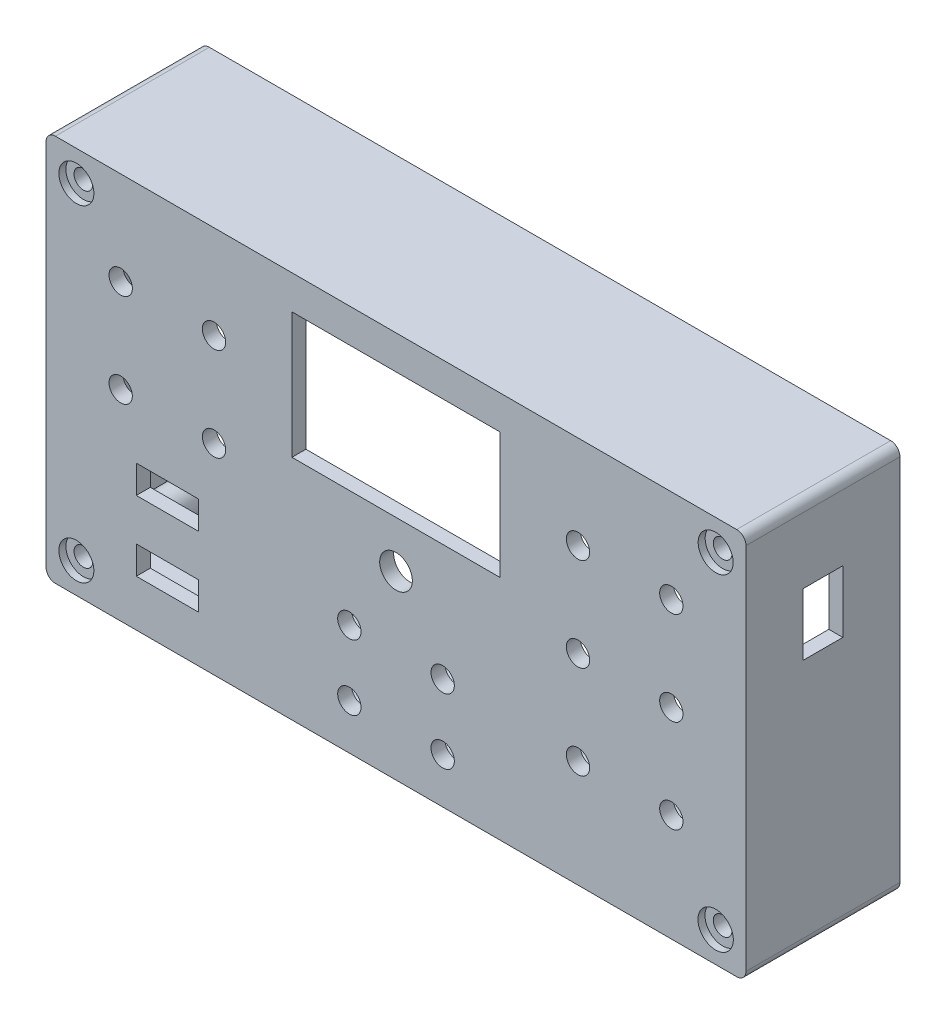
SolidWorks part; units mm, degrees
ref_plane "Alzado" through (0, 0, 0) normal (0, 0, 1) x (1, 0, 0)
ref_plane "Planta" through (0, 0, 0) normal (0, 1, 0) x (1, 0, 0)
ref_plane "Vista lateral" through (0, 0, 0) normal (1, 0, 0) x (0, 0, -1)
sketch "Croquis1" plane through (0, 0, 0) normal (0, 0, 1) x (1, 0, 0)
  line L1 (75, -41.5) -> (-75, -41.5)
  line L2 (75, -41.5) -> (75, 41.5)
  line L3 (75, 41.5) -> (-75, 41.5)
  line L4 (-75, -41.5) -> (-75, 41.5)
  line L5 (75, -41.5) -> (-75, 41.5) construction
  line L6 (75, 41.5) -> (-75, -41.5) construction
  point P0 (0, 0)
extrude "Saliente-Extruir1" add sketch "Croquis1" against normal blind 3
sketch "Croquis2" plane through (0, 0, -3) normal (0, 0, -1) x (-1, 0, 0)
  line L0 (-75, 41.5) -> (-72, 41.5) construction
  line L1 (-75, 41.5) -> (75, 41.5) construction
  line L2 (-72, 41.5) -> (-72, 38.5) construction
  line L3 (75, -41.5) -> (75, -38.5) construction
  line L4 (75, 41.5) -> (75, -41.5) construction
  line L5 (75, -38.5) -> (72, -38.5) construction
  line L7 (72, -38.5) -> (-72, -38.5)
  line L8 (72, -38.5) -> (72, 38.5)
  line L9 (72, 38.5) -> (-72, 38.5)
  line L10 (-72, -38.5) -> (-72, 38.5)
  line L14 (75, -41.5) -> (75, 41.5)
  line L15 (75, 41.5) -> (-75, 41.5)
  line L16 (-75, 41.5) -> (-75, -41.5)
  line L17 (-75, -41.5) -> (75, -41.5)
  line L18 (75, -41.5) -> (75, 41.5)
  line L19 (75, 41.5) -> (-75, 41.5)
  line L20 (-75, 41.5) -> (-75, -41.5)
  line L21 (-75, -41.5) -> (75, -41.5)
  dimension "D1" = 0
extrude "Saliente-Extruir2" add sketch "Croquis2" along normal blind 30
sketch "Croquis4" plane through (0, 0, -3) normal (0, 0, -1) x (-1, 0, 0)
  line L0 (-72, 35) -> (-72, 38.5)
  line L2 (-72, 38.5) -> (-68.5, 38.5)
  line L3 (0, 0) -> (0, 8.8651) construction
  line L4 (0, 0) -> (-5.9844, 0) construction
  line L6 (-72, -35) -> (-72, -38.5)
  line L7 (-72, -38.5) -> (-68.5, -38.5)
  line L8 (72, -35) -> (72, -38.5)
  line L9 (72, -38.5) -> (68.5, -38.5)
  line L10 (68.5, 38.5) -> (72, 38.5)
  line L11 (72, 38.5) -> (72, 35)
  arc A0 (-72, 35) -> (-68.5, 38.5) centre (-68.5, 35) ccw
  circle A1 centre (-68.5, 35) radius 2
  circle A2 centre (-68.5, -35) radius 2
  arc A3 (-72, -35) -> (-68.5, -38.5) centre (-68.5, -35) cw
  arc A4 (72, -35) -> (68.5, -38.5) centre (68.5, -35) ccw
  circle A5 centre (68.5, -35) radius 2
  circle A6 centre (68.5, 35) radius 2
  arc A7 (72, 35) -> (68.5, 38.5) centre (68.5, 35) cw
extrude "Saliente-Extruir8" add sketch "Croquis4" along normal blind 30
sketch "Croquis5" plane through (0, 0, -3) normal (0, 0, -1) x (-1, 0, 0)
  circle A1 centre (-68.5, 35) radius 2
  circle A2 centre (-68.5, 35) radius 2
  circle A3 centre (-68.5, -35) radius 2
  circle A4 centre (-68.5, -35) radius 2
  circle A5 centre (68.5, -35) radius 2
  circle A6 centre (68.5, -35) radius 2
  circle A7 centre (68.5, 35) radius 2
  circle A8 centre (68.5, 35) radius 2
  dimension "D1" = 0
  dimension "D2" = 0
  dimension "D3" = 0
  dimension "D4" = 0
extrude "Cortar-Extruir1" cut sketch "Croquis5" against normal blind 3
sketch "Croquis6" plane through (0, 0, 0) normal (0, 0, 1) x (1, 0, 0)
  line L0 (0, 41.5) -> (0, 0) construction
  line L1 (75, 41.5) -> (-75, 41.5) construction
  line L3 (22.3, 7.25) -> (-22.3, 7.25)
  line L4 (22.3, 7.25) -> (22.3, 34.25)
  line L5 (22.3, 34.25) -> (-22.3, 34.25)
  line L6 (-22.3, 7.25) -> (-22.3, 34.25)
  line L7 (22.3, 7.25) -> (-22.3, 34.25) construction
  line L8 (22.3, 34.25) -> (-22.3, 7.25) construction
  point P5 (0, 20.75)
extrude "Cortar-Extruir2" cut sketch "Croquis6" against normal blind 3
sketch "Croquis7" plane through (0, 0, 0) normal (0, 0, 1) x (1, 0, 0)
  line L0 (0, 7.25) -> (0, -2.75) construction
  line L1 (-22.3, 7.25) -> (22.3, 7.25) construction
  circle A0 centre (0, -2.75) radius 7.5 construction
  circle A1 centre (0, -2.75) radius 3.5
extrude "Cortar-Extruir3" cut sketch "Croquis7" against normal blind 3
sketch "Croquis8" plane through (0, 0, 0) normal (0, 0, 1) x (1, 0, 0)
  line L0 (0, 7.25) -> (0, -17.75) construction
  line L1 (-22.3, 7.25) -> (22.3, 7.25) construction
  line L2 (0, -17.75) -> (-10, -17.75) construction
  circle A0 centre (-10, -17.75) radius 2.5
  circle A1 centre (10, -17.75) radius 2.5
extrude "Cortar-Extruir4" cut sketch "Croquis8" against normal blind 3
sketch "Croquis9" plane through (0, 0, 0) normal (0, 0, 1) x (1, 0, 0)
  line L0 (0, -2.75) -> (0, -31.75) construction
  line L1 (0, -31.75) -> (-10, -31.75) construction
  circle A0 centre (-10, -31.75) radius 2.5
  circle A1 centre (10, -31.75) radius 2.5
extrude "Cortar-Extruir5" cut sketch "Croquis9" against normal blind 3
sketch "Croquis10" plane through (0, 0, 0) normal (0, 0, 1) x (1, 0, 0)
  line L0 (75, 41.5) -> (75, 21.5) construction
  line L1 (75, -41.5) -> (75, 41.5) construction
  line L2 (75, 21.5) -> (49, 21.5) construction
  line L3 (49, 21.5) -> (49, 25.4762) construction
  line L4 (49, 21.5) -> (39, 21.5) construction
  line L5 (0, 7.25) -> (0, 13.805) construction
  line L6 (-22.3, 7.25) -> (22.3, 7.25) construction
  line L7 (-49, 21.5) -> (-39, 21.5) construction
  line L8 (-49, 21.5) -> (-49, 25.4762) construction
  circle A0 centre (39, 21.5) radius 2.5
  circle A1 centre (59, 21.5) radius 2.5
  circle A2 centre (59, 1.5) radius 2.5
  circle A3 centre (59, -18.5) radius 2.5
  circle A4 centre (39, 1.5) radius 2.5
  circle A5 centre (39, -18.5) radius 2.5
  circle A7 centre (-39, 1.5) radius 2.5
  circle A9 centre (-59, 1.5) radius 2.5
  circle A10 centre (-59, 21.5) radius 2.5
  circle A11 centre (-39, 21.5) radius 2.5
  dimension "D1" = 2
  dimension "D2" = 3
extrude "Cortar-Extruir6" cut sketch "Croquis10" against normal blind 3
sketch "Croquis11" plane through (0, 0, 0) normal (0, 0, 1) x (1, 0, 0)
  line L0 (-56.5, 1.5) -> (-41.5, 1.5) construction
  line L1 (-49, 1.5) -> (-49, -13.5) construction
  line L2 (-42.35, -31.5) -> (-55.65, -25.5) construction
  line L3 (-42.35, -16.5) -> (-55.65, -16.5)
  line L4 (-42.35, -16.5) -> (-42.35, -10.5)
  line L5 (-42.35, -10.5) -> (-55.65, -10.5)
  line L6 (-55.65, -16.5) -> (-55.65, -10.5)
  line L7 (-42.35, -16.5) -> (-55.65, -10.5) construction
  line L8 (-42.35, -10.5) -> (-55.65, -16.5) construction
  line L9 (-42.35, -25.5) -> (-55.65, -31.5) construction
  line L10 (-42.35, -31.5) -> (-42.35, -25.5)
  line L11 (-42.35, -31.5) -> (-55.65, -31.5)
  line L12 (-55.65, -31.5) -> (-55.65, -25.5)
  line L13 (-42.35, -25.5) -> (-55.65, -25.5)
  circle A0 centre (-59, 1.5) radius 2.5 construction
  circle A1 centre (-39, 1.5) radius 2.5 construction
  dimension "D1" = 2
extrude "Cortar-Extruir7" cut sketch "Croquis11" against normal blind 3
sketch "Croquis13" plane through (0, -41.5, 0) normal (0, -1, 0) x (1, 0, 0)
  line L0 (75, 0) -> (65, 0) construction
  line L1 (-75, 0) -> (75, 0) construction
  line L2 (65, 0) -> (65, -33) construction
  line L3 (65, -16.5) -> (11.2, -16.5) construction
  line L4 (65, -4.35) -> (53.2, -4.35) construction
  line L5 (65, -28.65) -> (11.2, -28.65) construction
  line L6 (65, -28.65) -> (65, -4.35) construction
  line L7 (65, -4.35) -> (11.2, -4.35) construction
  line L8 (11.2, -28.65) -> (11.2, -4.35) construction
  line L9 (65, -28.65) -> (11.2, -4.35) construction
  line L10 (65, -4.35) -> (11.2, -28.65) construction
  line L11 (53.2, -4.35) -> (53.2, -6.85) construction
  line L12 (11.2, -28.65) -> (20.2, -28.65) construction
  line L13 (20.2, -28.65) -> (20.2, -26.15) construction
  circle A0 centre (20.2, -26.15) radius 2
  circle A1 centre (53.2, -6.85) radius 2
  point P9 (38.1, -16.5)
extrude "Cortar-Extruir8" cut sketch "Croquis13" against normal blind 3
sketch "Croquis14" plane through (0, -41.5, 0) normal (0, -1, 0) x (1, 0, 0)
  circle A0 centre (53.2, -6.85) radius 3.75
  circle A1 centre (20.2, -26.15) radius 3.75
  circle A2 centre (20.2, -26.15) radius 2 construction
  circle A3 centre (20.2, -26.15) radius 2
  circle A4 centre (53.2, -6.85) radius 2 construction
  circle A5 centre (53.2, -6.85) radius 2
extrude "Cortar-Extruir9" cut sketch "Croquis14" against normal blind 1.5
sketch "Croquis15" plane through (0, 0, 0) normal (0, 0, 1) x (1, 0, 0)
  circle A0 centre (-68.5, 35) radius 3.75
  circle A1 centre (-68.5, -35) radius 3.75
  circle A2 centre (68.5, -35) radius 3.79
  circle A3 centre (68.5, 35) radius 3.75
  circle A4 centre (-68.5, -35) radius 2 construction
  circle A5 centre (-68.5, -35) radius 2
  circle A6 centre (-68.5, 35) radius 2 construction
  circle A7 centre (-68.5, 35) radius 2
  circle A8 centre (68.5, 35) radius 2 construction
  circle A9 centre (68.5, 35) radius 2
  circle A10 centre (68.5, -35) radius 2 construction
  circle A11 centre (68.5, -35) radius 2
extrude "Cortar-Extruir10" cut sketch "Croquis15" against normal blind 1.5
fillet "Redondeo1" radius 2 4 edges at (75, -41.5, -16.5) (75, 41.5, -16.5) (-75, -41.5, -16.5) (-75, 41.5, -16.5)
sketch "Croquis16" plane through (75, 0, 0) normal (1, 0, 0) x (0, 0, -1)
  line L0 (0, 0.75) -> (0, 24) construction
  line L1 (0, 24) -> (33, 24) construction
  line L2 (33, 39.5) -> (33, -39.5) construction
  line L3 (0, 0.75) -> (0, 18.75) construction
  line L4 (0, 18.75) -> (33, 18.75) construction
  line L6 (20.75, 12.1) -> (12.25, 12.1)
  line L7 (20.75, 12.1) -> (20.75, 25.4)
  line L8 (20.75, 25.4) -> (12.25, 25.4)
  line L9 (12.25, 12.1) -> (12.25, 25.4)
  line L10 (20.75, 12.1) -> (12.25, 25.4) construction
  line L11 (20.75, 25.4) -> (12.25, 12.1) construction
  point P9 (16.5, 18.75)
extrude "Cortar-Extruir12" cut sketch "Croquis16" against normal blind 3
